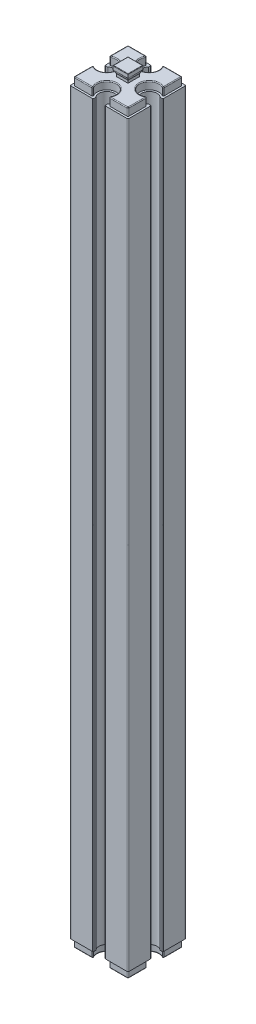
SolidWorks part; units mm, degrees
ref_plane "前视基准面" through (0, 0, 0) normal (0, 0, 1) x (1, 0, 0)
ref_plane "上视基准面" through (0, 0, 0) normal (0, 1, 0) x (1, 0, 0)
ref_plane "右视基准面" through (0, 0, 0) normal (1, 0, 0) x (0, 0, -1)
sketch "草图1" plane through (0, 0, 0) normal (0, 1, 0) x (1, 0, 0)
  line L0 (0, 0) -> (0, 7.5) construction
  line L1 (0, 0) -> (7.5, 0) construction
  line L2 (-7.5, 7.5) -> (-1.5, 7.5)
  line L3 (7.5, 7.5) -> (7.5, 1.5)
  line L4 (6.8229, 1.5) -> (7.5, 1.5)
  line L5 (6.8229, -1.5) -> (7.5, -1.5)
  line L6 (0, 7.5) -> (0, 5.5) construction
  line L7 (-1.5, 6.8229) -> (-1.5, 7.5)
  line L8 (1.5, 6.8229) -> (1.5, 7.5)
  line L9 (1.5, 7.5) -> (7.5, 7.5)
  line L10 (7.5, -1.5) -> (7.5, -7.5)
  line L11 (7.5, -7.5) -> (1.5, -7.5)
  line L12 (1.5, -6.8229) -> (1.5, -7.5)
  line L13 (-1.5, -6.8229) -> (-1.5, -7.5)
  line L14 (-1.5, -7.5) -> (-7.5, -7.5)
  line L15 (-7.5, -7.5) -> (-7.5, -1.5)
  line L16 (-6.8229, -1.5) -> (-7.5, -1.5)
  line L17 (-6.8229, 1.5) -> (-7.5, 1.5)
  line L18 (-7.5, 1.5) -> (-7.5, 7.5)
  arc A0 (-1.5, 6.8229) -> (1.5, 6.8229) centre (0, 5.5) ccw
  arc A1 (6.8229, 1.5) -> (6.8229, -1.5) centre (5.5, 0) ccw
  arc A2 (1.5, -6.8229) -> (-1.5, -6.8229) centre (0, -5.5) ccw
  arc A3 (-6.8229, -1.5) -> (-6.8229, 1.5) centre (-5.5, 0) ccw
  point P36 (0, 0)
  dimension "D6" = 4
  dimension "D7" = 2
  dimension "D1" = 7.5
  dimension "D2" = 7.5
  dimension "D3" = 2
  dimension "D4" = 7.5
  dimension "D5" = 1.5
extrude "凸台-拉伸1" add sketch "草图1" along normal blind 95.5
sketch "草图2" plane through (0, 95.5, 0) normal (0, 1, 0) x (1, 0, 0)
  line L0 (-7, 7) -> (-7, 2)
  line L1 (-7, 2) -> (-7, 2)
  line L2 (-7, -2) -> (-7, -2)
  line L3 (-7, -2) -> (-7, -7)
  line L4 (-7, -7) -> (-2, -7)
  line L5 (-2, -7) -> (-2, -7)
  line L6 (2, -7) -> (2, -7)
  line L7 (2, -7) -> (7, -7)
  line L8 (7, -7) -> (7, -2)
  line L9 (7, -2) -> (7, -2)
  line L10 (7, 2) -> (7, 2)
  line L11 (7, 2) -> (7, 7)
  line L12 (7, 7) -> (2, 7)
  line L13 (2, 7) -> (2, 7)
  line L14 (-2, 7) -> (-2, 7)
  line L15 (-2, 7) -> (-7, 7)
  line L16 (-7.5, 7.5) -> (-7.5, 1.5)
  line L17 (-7.5, 1.5) -> (-6.8229, 1.5)
  line L18 (-6.8229, -1.5) -> (-7.5, -1.5)
  line L19 (-7.5, -1.5) -> (-7.5, -7.5)
  line L20 (-7.5, -7.5) -> (-1.5, -7.5)
  line L21 (-1.5, -7.5) -> (-1.5, -6.8229)
  line L22 (1.5, -6.8229) -> (1.5, -7.5)
  line L23 (1.5, -7.5) -> (7.5, -7.5)
  line L24 (7.5, -7.5) -> (7.5, -1.5)
  line L25 (7.5, -1.5) -> (6.8229, -1.5)
  line L26 (6.8229, 1.5) -> (7.5, 1.5)
  line L27 (7.5, 1.5) -> (7.5, 7.5)
  line L28 (7.5, 7.5) -> (1.5, 7.5)
  line L29 (1.5, 7.5) -> (1.5, 6.8229)
  line L30 (-1.5, 6.8229) -> (-1.5, 7.5)
  line L31 (-1.5, 7.5) -> (-7.5, 7.5)
  line L32 (-7.5, 7.5) -> (-7.5, 1.5) construction
  line L33 (-7.5, 1.5) -> (-6.8229, 1.5) construction
  line L34 (-6.8229, -1.5) -> (-7.5, -1.5) construction
  line L35 (-7.5, -1.5) -> (-7.5, -7.5) construction
  line L36 (-7.5, -7.5) -> (-1.5, -7.5) construction
  line L37 (-1.5, -7.5) -> (-1.5, -6.8229) construction
  line L38 (1.5, -6.8229) -> (1.5, -7.5) construction
  line L39 (1.5, -7.5) -> (7.5, -7.5) construction
  line L40 (7.5, -7.5) -> (7.5, -1.5) construction
  line L41 (7.5, -1.5) -> (6.8229, -1.5) construction
  line L42 (6.8229, 1.5) -> (7.5, 1.5) construction
  line L43 (7.5, 1.5) -> (7.5, 7.5) construction
  line L44 (7.5, 7.5) -> (1.5, 7.5) construction
  line L45 (1.5, 7.5) -> (1.5, 6.8229) construction
  line L46 (-1.5, 6.8229) -> (-1.5, 7.5) construction
  line L47 (-1.5, 7.5) -> (-7.5, 7.5) construction
  arc A0 (-7, -2) -> (-7, 2) centre (-5.5, 0) ccw
  arc A1 (2, -7) -> (-2, -7) centre (0, -5.5) ccw
  arc A2 (7, 2) -> (7, -2) centre (5.5, 0) ccw
  arc A3 (-2, 7) -> (2, 7) centre (0, 5.5) ccw
  arc A4 (-6.8229, -1.5) -> (-6.8229, 1.5) centre (-5.5, 0) ccw
  arc A5 (1.5, -6.8229) -> (-1.5, -6.8229) centre (0, -5.5) ccw
  arc A6 (6.8229, 1.5) -> (6.8229, -1.5) centre (5.5, 0) ccw
  arc A7 (-1.5, 6.8229) -> (1.5, 6.8229) centre (0, 5.5) ccw
  arc A8 (-6.8229, -1.5) -> (-6.8229, 1.5) centre (-5.5, 0) ccw construction
  arc A9 (1.5, -6.8229) -> (-1.5, -6.8229) centre (0, -5.5) ccw construction
  arc A10 (6.8229, 1.5) -> (6.8229, -1.5) centre (5.5, 0) ccw construction
  arc A11 (-1.5, 6.8229) -> (1.5, 6.8229) centre (0, 5.5) ccw construction
  dimension "D1" = 0
  dimension "D2" = 0.5
extrude "凸台-拉伸2" add sketch "草图2" along normal blind 2
sketch "草图3" plane through (0, 0, 0) normal (1, 0, 0) x (0, 0, -1)
  line L0 (0, 97.5) -> (0, 99.5) construction
  line L1 (2.5, 97.5) -> (-2.5, 97.5) construction
  line L2 (0, 99.5) -> (0, 100) construction
  line L3 (-1.5, 97.5) -> (1.5, 97.5)
  line L4 (1.5, 97.5) -> (1.5, 98.1771)
  line L5 (-1.95, 100) -> (1.95, 100)
  line L6 (1.95, 100) -> (1.95, 99.0556)
  line L7 (-1.5, 97.5) -> (-1.5, 98.1771)
  line L8 (-1.95, 100) -> (-1.95, 99.0556)
  arc A0 (-1.5, 98.1771) -> (-1.95, 99.0556) centre (0, 99.5) cw
  arc A1 (1.5, 98.1771) -> (1.95, 99.0556) centre (0, 99.5) ccw
  dimension "D5" = 2
  dimension "D1" = 2
  dimension "D2" = 0.5
  dimension "D3" = 1.5
  dimension "D4" = 1.95
extrude "凸台-拉伸3" add sketch "草图3" along normal blind 2 and the other way blind 2
sketch "草图4" plane through (0, 0, 0) normal (0, 0, 1) x (1, 0, 0)
  line L0 (0, 97.5) -> (0, 99.5) construction
  line L2 (-2, 97.5) -> (2, 97.5) construction
  line L3 (0, 99.5) -> (0, 100) construction
  line L4 (-2, 100) -> (2, 100) construction
  line L5 (1.95, 100) -> (2, 100)
  line L6 (-1.95, 100) -> (-1.95, 99.0556)
  line L9 (-1.5, 97.5) -> (-1.5, 98.1771)
  line L10 (1.5, 97.5) -> (1.5, 98.1771)
  line L11 (1.95, 100) -> (1.95, 99.0556)
  line L12 (1.5, 97.5) -> (2, 97.5)
  line L13 (-2, 100) -> (-1.95, 100)
  line L14 (-2, 100) -> (-2, 97.5)
  line L15 (-2, 97.5) -> (-1.5, 97.5)
  line L16 (2, 100) -> (2, 97.5)
  arc A0 (-1.95, 99.0556) -> (-1.5, 98.1771) centre (0, 99.5) ccw
  arc A1 (1.95, 99.0556) -> (1.5, 98.1771) centre (0, 99.5) cw
  dimension "D1" = 2
  dimension "D2" = 1.5
  dimension "D3" = 1.95
fillet "圆角3" radius 0.2 13 edges at (-1.5, 47.75, -7.5) (1.5, 47.75, -7.5) (7.5, 47.75, -7.5) (7.5, 47.75, -1.5) (7.5, 47.75, 1.5) (7.5, 47.75, 7.5) (-1.5, 47.75, 7.5) (1.5, 47.75, 7.5) (-6.8229, 47.75, -1.5) (-7.5, 47.75, 7.5) (-7.5, 47.75, 1.5) (-7.5, 47.75, -1.5) (-7.5, 47.75, -7.5)
extrude "切除-拉伸1" cut sketch "草图4" against normal blind 3 and the other way blind 3
fillet "圆角4" radius 0.2 24 edges at (0, 97.5, 3) (-3, 97.5, 0) (0, 97.5, -3) (3, 97.5, 0) (7, 96.5, 2) (7, 96.5, -2) (2, 96.5, -7) (-2, 96.5, -7) (-7, 96.5, 2) (-7, 96.5, -2) (2, 96.5, 7) (-2, 96.5, 7) (7, 96.5, 7) (4.5, 97.5, 7) (7, 97.5, 4.5) (7, 97.5, -4.5) (7, 96.5, -7) (4.5, 97.5, -7) (-4.5, 97.5, -7) (-7, 96.5, -7) (-7, 97.5, -4.5) (-4.5, 97.5, 7) (-7, 97.5, 4.5) (-7, 96.5, 7)
fillet "圆角5" radius 0.1 4 edges at (0, 100, -1.95) (1.95, 100, 0) (0, 100, 1.95) (-1.95, 100, 0)
mirror "镜向1" of "圆角5", "圆角4", "切除-拉伸1", "圆角3", "凸台-拉伸3", "凸台-拉伸2", "凸台-拉伸1"
